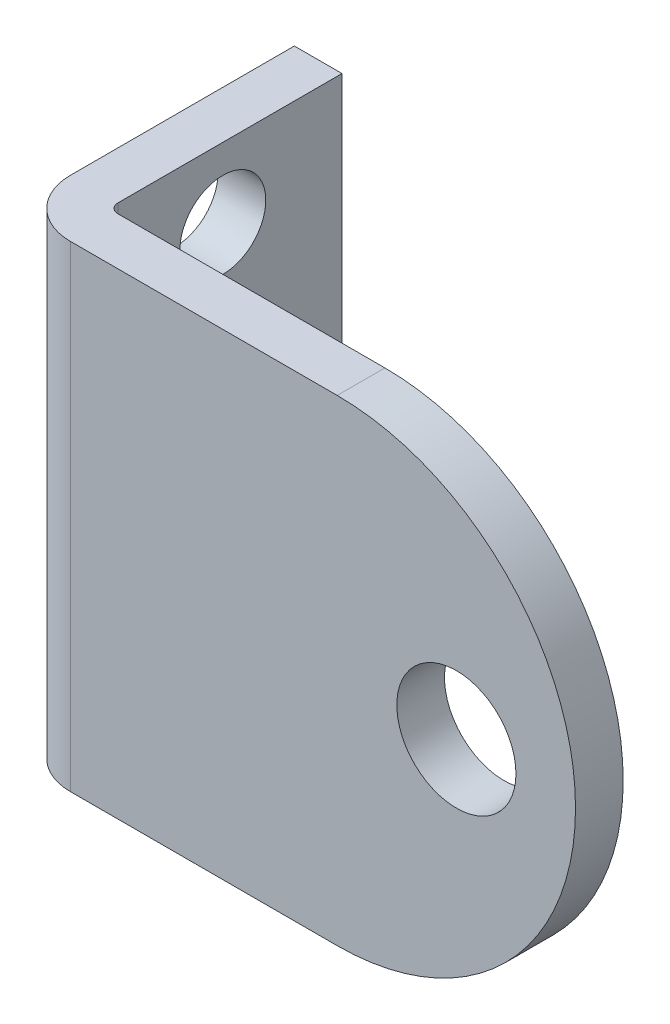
SolidWorks part; units mm, degrees
ref_plane "Plan de face" through (0, 0, 0) normal (0, 0, 1) x (1, 0, 0)
ref_plane "Plan de dessus" through (0, 0, 0) normal (0, 1, 0) x (1, 0, 0)
ref_plane "Plan de droite" through (0, 0, 0) normal (1, 0, 0) x (0, 0, -1)
sketch "Esquisse1" plane through (0, 0, 0) normal (0, 0, 1) x (1, 0, 0)
  line L1 (0, 25) -> (34, 25)
  line L2 (0, 25) -> (0, -25)
  line L3 (0, -25) -> (34, -25)
  circle A0 centre (46.5, 0) radius 6.25
  arc A1 (34, 25) -> (34, -25) centre (34, 0) cw
  dimension "D3" = 12.5
  dimension "D5" = 25
  dimension "D1" = 50
  dimension "D2" = 46.5
  dimension "D6" = 34
extrude "Extrusion1" add sketch "Esquisse1" along normal blind 5
sketch "Esquisse2" plane through (0, 0, 5) normal (0, 0, 1) x (1, 0, 0)
  line L0 (0, -25) -> (34, -25) construction
  line L1 (0, 25) -> (5, 25)
  line L2 (0, 25) -> (0, -25)
  line L3 (0, -25) -> (5, -25)
  line L4 (5, 25) -> (5, -25)
  dimension "D1" = 5
extrude "Extrusion2" add sketch "Esquisse2" against normal blind 29.5
fillet "Congé1" radius 6 1 edges at (0, 0, 5)
fillet "Congé2" radius 1 1 edges at (5, 0, 0)
sketch "Esquisse3" plane through (0, 0, 0) normal (-1, 0, 0) x (0, 0, 1)
  line L0 (-24.5, 25) -> (-24.5, -25) construction
  circle A0 centre (-12, -17.5) radius 4.5
  circle A1 centre (-12, 17.5) radius 4.5
  dimension "D1" = 9
  dimension "D2" = 9
  dimension "D3" = 35
  dimension "D4" = 17.5
  dimension "D5" = 12.5
extrude "Enlèv. mat.-Extru.1" cut sketch "Esquisse3" against normal through all
